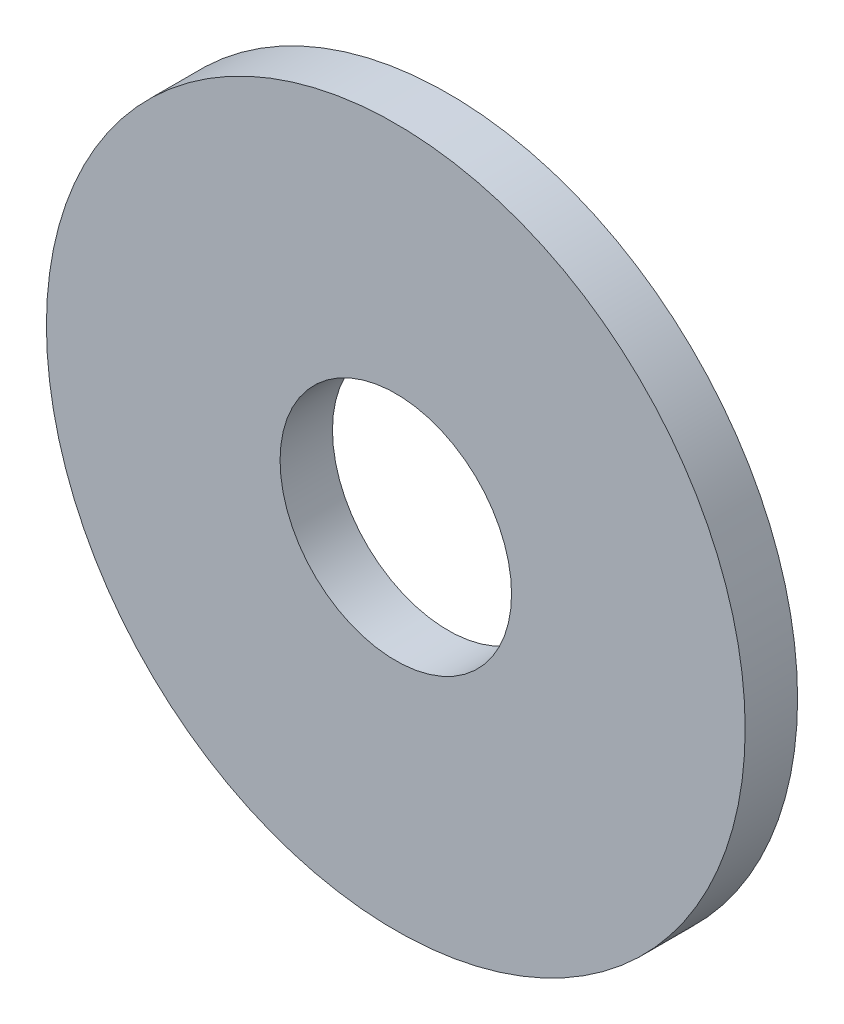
SolidWorks part; units mm, degrees
ref_plane "Plan de face" through (0, 0, 0) normal (0, 0, 1) x (1, 0, 0)
ref_plane "Plan de dessus" through (0, 0, 0) normal (0, 1, 0) x (1, 0, 0)
ref_plane "Plan de droite" through (0, 0, 0) normal (1, 0, 0) x (0, 0, -1)
sketch "Esquisse1" plane through (0, 0, 0) normal (0, 0, 1) x (1, 0, 0)
  circle A0 centre (0, 0) radius 8
  circle A1 centre (0, 0) radius 2.65
extrude "Extrusion1" add sketch "Esquisse1" along normal blind 1.2
